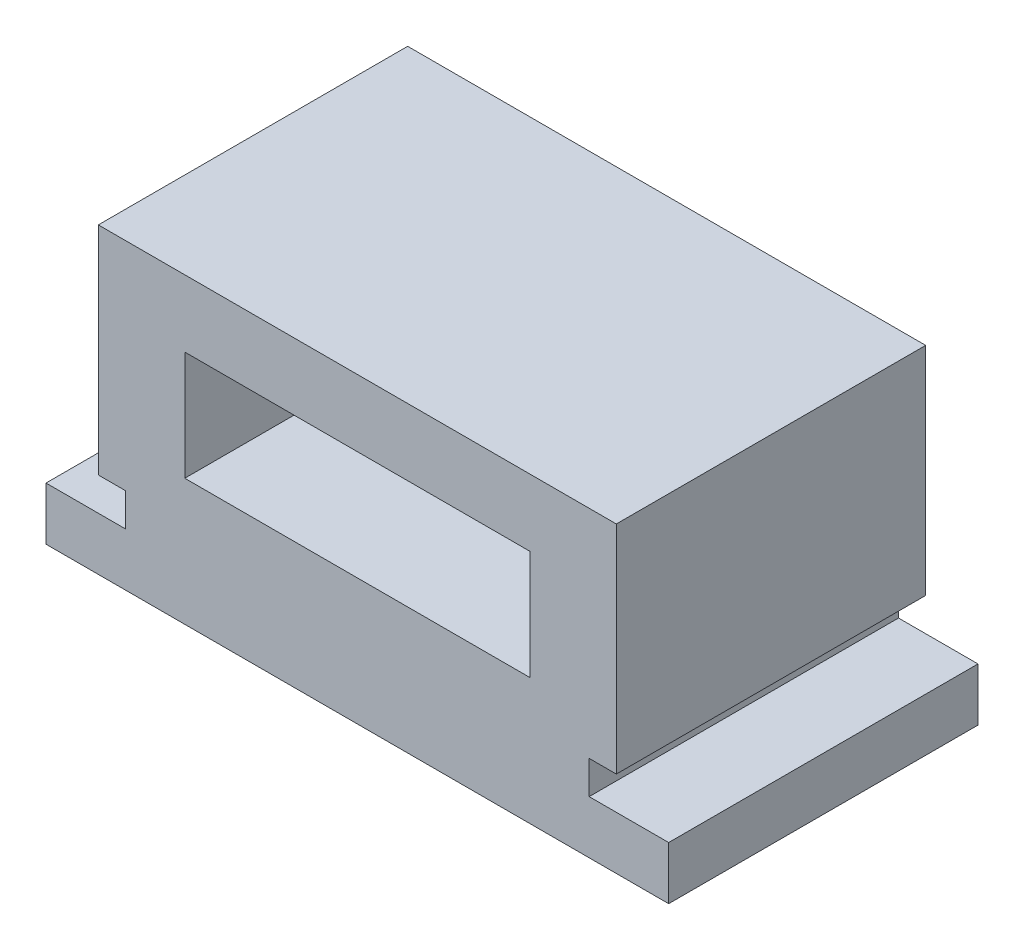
SolidWorks part; units mm, degrees
ref_plane "前视基准面" through (0, 0, 0) normal (0, 0, 1) x (1, 0, 0)
ref_plane "上视基准面" through (0, 0, 0) normal (0, 1, 0) x (1, 0, 0)
ref_plane "右视基准面" through (0, 0, 0) normal (1, 0, 0) x (0, 0, -1)
sketch "草图1" plane through (0, 0, 0) normal (0, 0, 1) x (1, 0, 0)
  line L0 (-4.7, 0) -> (4.7, 0)
  line L1 (4.7, 0) -> (4.7, 0.8)
  line L2 (4.7, 0.8) -> (3.5, 0.8)
  line L3 (3.5, 0.8) -> (3.5, 1.3)
  line L4 (3.5, 1.3) -> (3.91, 1.3)
  line L5 (3.91, 1.3) -> (3.91, 4.57)
  line L6 (3.91, 4.57) -> (-3.91, 4.57)
  line L7 (-3.91, 4.57) -> (-3.91, 1.3)
  line L8 (-3.91, 1.3) -> (-3.5, 1.3)
  line L9 (-3.5, 1.3) -> (-3.5, 0.8)
  line L10 (-3.5, 0.8) -> (-4.7, 0.8)
  line L11 (-4.7, 0.8) -> (-4.7, 0)
  line L12 (0, 0) -> (0, 9.1954) construction
  line L14 (-2.605, 3.56) -> (2.605, 3.56)
  line L15 (-2.605, 3.56) -> (-2.605, 1.91)
  line L16 (-2.605, 1.91) -> (2.605, 1.91)
  line L17 (2.605, 3.56) -> (2.605, 1.91)
  line L18 (-2.605, 3.56) -> (2.605, 1.91) construction
  line L19 (-2.605, 1.91) -> (2.605, 3.56) construction
  point P15 (0, 2.735)
  dimension "D1" = 9.4
  dimension "D2" = 4.7
  dimension "D3" = 0.8
  dimension "D4" = 0.5
  dimension "D5" = 0.5
  dimension "D6" = 0.8
  dimension "D7" = 4.57
  dimension "D8" = 7.82
  dimension "D9" = 3.91
  dimension "D10" = 5.21
  dimension "D11" = 1.65
  dimension "D12" = 1.91
  dimension "D13" = 3.5
  dimension "D14" = 3.5
extrude "凸台-拉伸1" add sketch "草图1" against normal blind 4.67
